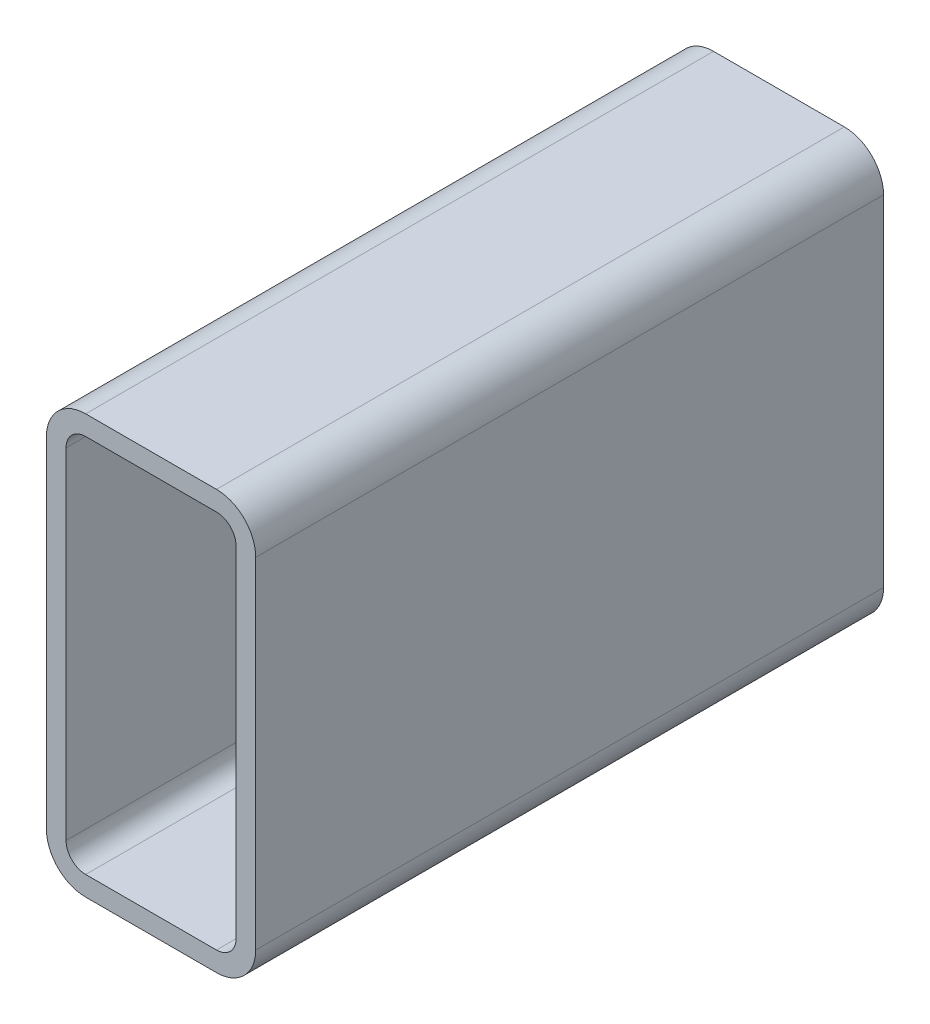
SolidWorks part; units mm, degrees
ref_plane "Front Plane" through (0, 0, 0) normal (0, 0, 1) x (1, 0, 0)
ref_plane "Top Plane" through (0, 0, 0) normal (0, 1, 0) x (1, 0, 0)
ref_plane "Right Plane" through (0, 0, 0) normal (1, 0, 0) x (0, 0, -1)
sketch "Sketch1" plane through (0, 0, 0) normal (0, 0, 1) x (1, 0, 0)
sketch_block_instance "HSS8x4x0.375-1"
sketch_block "HSS8x4x0.375"
extrude "Boss-Extrude1" add sketch "Sketch1" along normal blind 304.8
